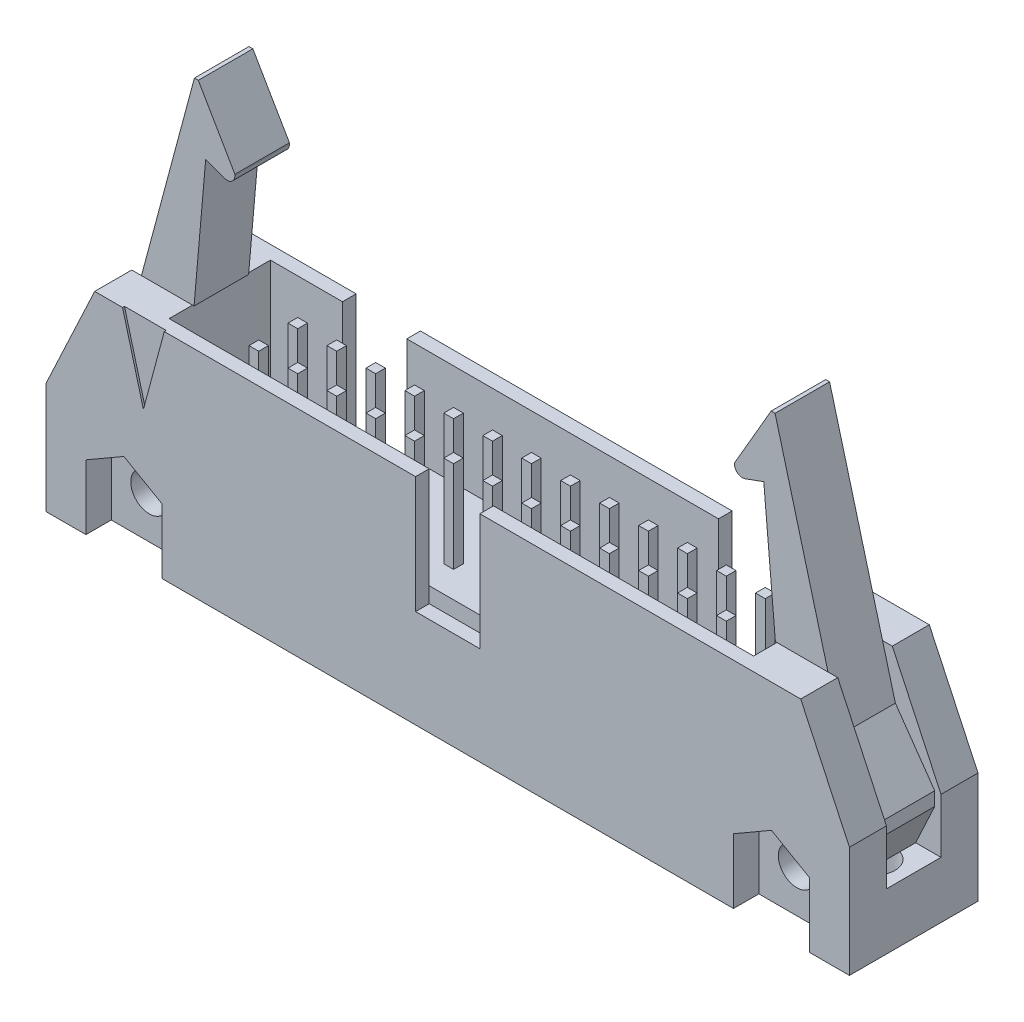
SolidWorks part; units mm, degrees
ref_plane "Front Plane" through (0, 0, 0) normal (0, 0, 1) x (1, 0, 0)
ref_plane "Top Plane" through (0, 0, 0) normal (0, 1, 0) x (1, 0, 0)
ref_plane "Right Plane" through (0, 0, 0) normal (1, 0, 0) x (0, 0, -1)
sketch "Sketch1" plane through (0, 0, 0) normal (0, 0, 1) x (1, 0, 0)
  line L1 (0, 0) -> (52.3748, 0)
  line L2 (0, 0) -> (0, 14.0208)
  line L3 (0, 14.0208) -> (52.3748, 14.0208)
  line L4 (52.3748, 0) -> (52.3748, 14.0208)
  dimension "D1" = 52.3748
  dimension "D2" = 14.0208
extrude "Base-Extrude" add sketch "Sketch1" against normal blind 8.382
sketch "Sketch2" plane through (0, 0, 0) normal (0, 0, 1) x (1, 0, 0)
  line L0 (26.1874, 14.0208) -> (26.1874, 0) construction
  line L1 (52.3748, 14.0208) -> (0, 14.0208) construction
  line L2 (0, 0) -> (52.3748, 0) construction
  line L3 (3.175, 14.0208) -> (0, 7.239)
  line L4 (0, 14.0208) -> (0, 0) construction
  line L5 (0, 14.0208) -> (0, 7.239)
  line L6 (0, 14.0208) -> (3.175, 14.0208)
  line L7 (52.3748, 14.0208) -> (49.1998, 14.0208)
  line L8 (52.3748, 14.0208) -> (52.3748, 7.239)
  line L9 (49.1998, 14.0208) -> (52.3748, 7.239)
  dimension "D1" = 7.239
  dimension "D2" = 3.175
extrude "Angle Cut Outside" cut sketch "Sketch2" against normal through all
sketch "Sketch3" plane through (0, 14.0208, 0) normal (0, 1, 0) x (-1, 0, 0)
  line L4 (-3.175, -4.191) -> (-49.1998, -4.191) construction
  line L5 (-3.175, -8.382) -> (-3.175, 0) construction
  line L6 (-49.1998, -8.382) -> (-49.1998, 0) construction
  line L7 (-26.1874, 0) -> (-26.1874, -8.382) construction
  line L8 (-49.1998, 0) -> (-3.175, 0) construction
  line L9 (-49.1998, -8.382) -> (-3.175, -8.382) construction
  line L10 (-7.1374, -7.493) -> (-7.1374, -0.889)
  line L11 (-7.1374, -0.889) -> (-45.2374, -0.889)
  line L12 (-45.2374, -7.493) -> (-45.2374, -0.889)
  line L13 (-7.1374, -7.493) -> (-45.2374, -7.493)
  point P16 (-26.1874, -0.889)
  point P18 (-45.2374, -4.191)
  point P19 (-7.1374, -4.191)
  dimension "D1" = 3.302
  dimension "D2" = 19.05
extrude "Inside Cut1" cut sketch "Sketch3" against normal blind 6.604
sketch "Sketch4" plane through (0, 0, 0) normal (0, 0, 1) x (1, 0, 0)
  line L0 (26.1874, 0) -> (26.1874, 14.0208) construction
  line L1 (0, 0) -> (52.3748, 0) construction
  line L2 (49.1998, 14.0208) -> (3.175, 14.0208) construction
  line L3 (24.0919, 14.0208) -> (24.0919, 6.4008)
  line L4 (24.0919, 6.4008) -> (28.2829, 6.4008)
  line L5 (24.0919, 14.0208) -> (28.2829, 14.0208)
  line L6 (28.2829, 14.0208) -> (28.2829, 6.4008)
  point P11 (26.1874, 6.4008)
  dimension "D1" = 2.0955
  dimension "D2" = 7.62
extrude "Center Cut1" cut sketch "Sketch4" against normal blind 0.889
sketch "Sketch5" plane through (0, 7.4168, 0) normal (0, 1, 0) x (-1, 0, 0)
  line L0 (-26.1874, 0) -> (-26.1874, -8.382) construction
  line L1 (-24.0919, 0) -> (-28.2829, 0) construction
  line L2 (-49.1998, -8.382) -> (-3.175, -8.382) construction
  line L3 (0, -4.191) -> (-52.3748, -4.191) construction
  line L4 (0, -8.382) -> (0, 0) construction
  line L5 (-52.3748, -8.382) -> (-52.3748, 0) construction
  line L6 (-11.2649, -3.2385) -> (-10.6299, -2.6035) construction
  line L7 (-10.6299, -2.6035) -> (-11.2649, -2.6035)
  line L8 (-10.6299, -2.6035) -> (-10.6299, -3.2385)
  line L9 (-10.6299, -3.2385) -> (-11.2649, -3.2385)
  line L10 (-11.2649, -2.6035) -> (-11.2649, -3.2385)
  circle A0 centre (-10.9474, -2.921) radius 0.3175 construction
  dimension "D3" = 0.635
  dimension "D1" = 15.24
  dimension "D2" = 1.27
extrude "Pin 1 Boss" add sketch "Sketch5" along normal blind 5.969
pattern_linear "26p Pattern" count 13 spacing 2.54 along (1, 0, 0) count 2 spacing 2.54 along (0, 0, -1) of "Pin 1 Boss"
sketch "Sketch6" plane through (0, 0, -8.382) normal (0, 0, -1) x (-1, 0, 0)
  line L0 (-26.1874, 0) -> (-26.1874, 14.0208) construction
  line L1 (0, 0) -> (-52.3748, 0) construction
  line L2 (-49.1998, 14.0208) -> (-3.175, 14.0208) construction
  line L3 (-40.5384, 14.0208) -> (-40.5384, 6.4008)
  line L4 (-40.5384, 6.4008) -> (-36.3474, 6.4008)
  line L5 (-36.3474, 6.4008) -> (-36.3474, 14.0208)
  line L6 (-40.5384, 14.0208) -> (-36.3474, 14.0208)
  line L7 (-11.8364, 14.0208) -> (-16.0274, 14.0208)
  line L8 (-16.0274, 6.4008) -> (-16.0274, 14.0208)
  line L9 (-11.8364, 6.4008) -> (-16.0274, 6.4008)
  line L10 (-11.8364, 14.0208) -> (-11.8364, 6.4008)
  dimension "D1" = 4.191
  dimension "D2" = 10.16
  dimension "D3" = 7.62
extrude "Rear Cut1" cut sketch "Sketch6" against normal blind 0.889
ref_plane "Latch Plane" through (0, 0, -2.413) normal (0, 0, 1) x (1, 0, 0)
sketch "Sketch7" plane through (0, 0, -2.413) normal (0, 0, 1) x (1, 0, 0)
  line L0 (26.1874, 0) -> (26.1874, 14.0208) construction
  line L1 (0, 0) -> (52.3748, 0) construction
  line L2 (36.3474, 14.0208) -> (16.0274, 14.0208) construction
  line L3 (44.3791, 22.6702) -> (45.1358, 14.0208)
  line L4 (24.0919, 14.0208) -> (3.175, 14.0208) construction
  line L5 (7.239, 14.0208) -> (3.81, 14.0208)
  line L6 (3.81, 14.0208) -> (7.2614, 26.9014)
  line L7 (7.2614, 26.9014) -> (7.5154, 26.9014)
  line L8 (7.5154, 26.9014) -> (9.9007, 22.7878)
  line L9 (9.9007, 22.7878) -> (9.9007, 22.7024)
  line L10 (9.219, 22.225) -> (7.9957, 22.6702)
  line L11 (7.9957, 22.6702) -> (7.239, 14.0208)
  line L12 (43.1558, 22.225) -> (44.3791, 22.6702)
  line L13 (42.4741, 22.7878) -> (42.4741, 22.7024)
  line L14 (44.8594, 26.9014) -> (42.4741, 22.7878)
  line L15 (45.1134, 26.9014) -> (44.8594, 26.9014)
  line L16 (48.5648, 14.0208) -> (45.1134, 26.9014)
  line L17 (45.1358, 14.0208) -> (48.5648, 14.0208)
  arc A0 (9.219, 22.225) -> (9.9007, 22.7024) centre (9.3927, 22.7024) ccw
  arc A1 (43.1558, 22.225) -> (42.4741, 22.7024) centre (42.9821, 22.7024) cw
  dimension "D9" = 0.508
  dimension "D1" = 0.635
  dimension "D2" = 13.335
  dimension "D3" = 75
  dimension "D4" = 3.429
  dimension "D5" = 22.225
  dimension "D6" = 85
  dimension "D7" = 0.254
  dimension "D8" = 1.905
  dimension "D10" = 0.762
  dimension "D11" = 75
extrude "Latches" add sketch "Sketch7" against normal blind 3.556
sketch "Sketch8" plane through (0, 0, -2.413) normal (0, 0, 1) x (1, 0, 0)
  line L0 (7.2614, 26.9014) -> (3.81, 14.0208) construction
  line L1 (3.81, 14.0208) -> (2.9747, 10.9033)
  line L2 (26.1874, 0) -> (26.1874, 14.0208) construction
  line L3 (0, 0) -> (52.3748, 0) construction
  line L4 (24.0919, 14.0208) -> (3.175, 14.0208) construction
  line L5 (0.4089, 7.239) -> (2.9747, 10.9033)
  line L6 (0.4089, 7.239) -> (0.4089, 6.35)
  line L7 (1.6525, 3.683) -> (0, 3.683)
  line L8 (0, 7.239) -> (0, 0) construction
  line L9 (0.4089, 6.35) -> (1.6525, 3.683)
  line L10 (0, 7.239) -> (0, 3.683)
  line L11 (0, 7.239) -> (3.175, 14.0208) construction
  line L12 (0, 7.239) -> (3.175, 14.0208)
  line L13 (3.81, 14.0208) -> (3.175, 14.0208)
  line L14 (48.5648, 14.0208) -> (49.1998, 14.0208)
  line L15 (52.3748, 7.239) -> (49.1998, 14.0208)
  line L16 (52.3748, 7.239) -> (52.3748, 3.683)
  line L17 (51.9659, 6.35) -> (50.7223, 3.683)
  line L18 (50.7223, 3.683) -> (52.3748, 3.683)
  line L19 (51.9659, 7.239) -> (51.9659, 6.35)
  line L20 (51.9659, 7.239) -> (49.4001, 10.9033)
  line L21 (48.5648, 14.0208) -> (49.4001, 10.9033)
  dimension "D1" = 3.683
  dimension "D2" = 1.6525
  dimension "D3" = 6.35
  dimension "D4" = 65
  dimension "D5" = 160
extrude "Latch Cut1" cut sketch "Sketch8" against normal blind 3.556
sketch "Sketch9" plane through (0, 0, 0) normal (0, 0, 1) x (1, 0, 0)
  line L0 (4.9888, 14.0208) -> (6.35, 8.9408)
  line L1 (24.0919, 14.0208) -> (3.175, 14.0208) construction
  line L2 (6.35, 8.9408) -> (7.7112, 14.0208)
  line L3 (7.7112, 14.0208) -> (4.9888, 14.0208)
  line L4 (6.35, 14.0208) -> (6.35, 0) construction
  line L5 (0, 0) -> (52.3748, 0) construction
  dimension "D1" = 30
  dimension "D2" = 6.35
  dimension "D3" = 5.08
extrude "Pin 1 Triangle Cut" cut sketch "Sketch9" against normal blind 0.127
sketch "Sketch10" plane through (0, 0, 0) normal (0, 0, 1) x (1, 0, 0)
  line L0 (26.1874, 0) -> (26.1874, 14.0208) construction
  line L1 (0, 0) -> (52.3748, 0) construction
  line L2 (36.3474, 14.0208) -> (16.0274, 14.0208) construction
  line L3 (5.9524, 0.4381) -> (7.3994, 1.2735)
  line L4 (2.271, 1.5562) -> (3.718, 0.7208)
  line L5 (7.5565, 0) -> (7.5565, 4.2238)
  line L6 (7.5565, 4.2238) -> (5.08, 5.6536)
  line L7 (5.08, 5.6536) -> (2.6035, 4.2238)
  line L8 (2.6035, 4.2238) -> (2.6035, 0)
  line L9 (2.6035, 0) -> (7.5565, 0)
  line L10 (49.7713, 0) -> (44.8183, 0)
  line L11 (49.7713, 4.2238) -> (49.7713, 0)
  line L12 (47.2948, 5.6536) -> (49.7713, 4.2238)
  line L13 (44.8183, 4.2238) -> (47.2948, 5.6536)
  line L14 (44.8183, 0) -> (44.8183, 4.2238)
  circle A0 centre (5.08, 2.794) radius 2.4765 construction
  circle A1 centre (47.2948, 2.794) radius 2.4765 construction
  dimension "D1" = 4.953
  dimension "D2" = 2.794
  dimension "D3" = 5.08
  dimension "D4" = 21.1074
extrude "Screw Recess" cut sketch "Sketch10" against normal blind 1.651
sketch "Sketch12" plane through (0, 0, 0) normal (0, 0, 1) x (1, 0, 0)
  line L0 (26.1874, 0) -> (26.1874, 14.0208) construction
  line L1 (7.5565, 0) -> (44.8183, 0) construction
  line L2 (36.3474, 14.0208) -> (16.0274, 14.0208) construction
  circle A0 centre (5.08, 2.794) radius 1.2065
  circle A1 centre (47.2948, 2.794) radius 1.2065
  dimension "D1" = 2.413
extrude "Screw Hole" cut sketch "Sketch12" against normal through all
sketch "Sketch13" plane through (0, 0, 0) normal (0, -1, 0) x (1, 0, 0)
  line L0 (26.1874, -8.382) -> (26.1874, 0) construction
  line L1 (0, -8.382) -> (52.3748, -8.382) construction
  line L2 (7.5565, 0) -> (44.8183, 0) construction
  line L3 (0, -8.382) -> (0, 0) construction
  circle A0 centre (2.032, -3.7338) radius 1.27
  circle A1 centre (50.3428, -3.7338) radius 1.27
  dimension "D1" = 2.54
  dimension "D2" = 3.7338
  dimension "D3" = 2.032
  dimension "D4" = 24.1554
extrude "Vert Mnt Hole" cut sketch "Sketch13" against normal up to surface (3.683 mm away)
sketch "Sketch15" plane through (0, 0, -8.382) normal (0, 0, -1) x (-1, 0, 0)
  line L0 (-26.1874, 0) -> (-26.1874, 14.0208) construction
  line L1 (0, 0) -> (-52.3748, 0) construction
  line L2 (-36.3474, 14.0208) -> (-16.0274, 14.0208) construction
  line L3 (-8.9154, 0) -> (-8.9154, 4.318)
  line L4 (-8.9154, 4.318) -> (-43.4594, 4.318)
  line L5 (-43.4594, 0) -> (-8.9154, 0)
  line L6 (-43.4594, 0) -> (-43.4594, 4.318)
  point P10 (-26.1874, 4.318)
  dimension "D1" = 17.272
  dimension "D2" = 4.318
extrude "R Ang Rear Cut1" cut sketch "Sketch15" against normal blind 1.524
sketch "Sketch14" plane through (0, 0, -6.858) normal (0, 0, -1) x (-1, 0, 0)
  line L0 (-47.2948, 2.794) -> (-5.08, 2.794) construction
  line L1 (-26.1874, 2.794) -> (-26.1874, 14.0208) construction
  line L3 (-36.3474, 14.0208) -> (-16.0274, 14.0208) construction
  circle A0 centre (-10.9474, 0.9906) radius 0.4445
  dimension "D1" = 0.889
  dimension "D2" = 1.8034
  dimension "D3" = 15.24
extrude "R Ang Pin1" [suppressed] add sketch "Sketch14" along normal blind 4.318
pattern_linear "R Ang Pattern" [suppressed] count 13 spacing 2.54 count 2 spacing 2.54
